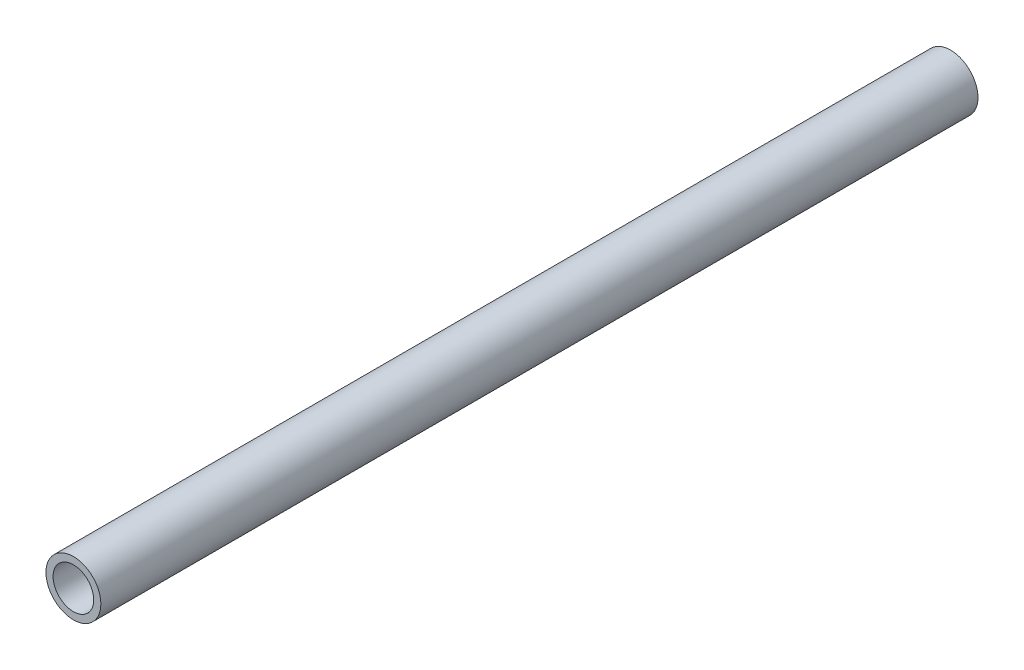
SolidWorks part; units mm, degrees
ref_plane "Front" through (0, 0, 0) normal (0, 0, 1) x (1, 0, 0)
ref_plane "Top" through (0, 0, 0) normal (0, 1, 0) x (1, 0, 0)
ref_plane "Side" through (0, 0, 0) normal (1, 0, 0) x (0, 0, -1)
sketch "PipeSketch"
  dimension "OuterDiameter" = 21.336
  dimension "InnerDiameter" = 15.7988
extrude "Extrusion" add sketch "PipeSketch" along normal blind 340.921
sketch "FilterSketch" plane through (0, 0, 0) normal (0, 0, 1) x (1, 0, 0)
  circle A0 centre (0, 0) radius 6.35 construction
  dimension "NominalDiameter" = 12.7
